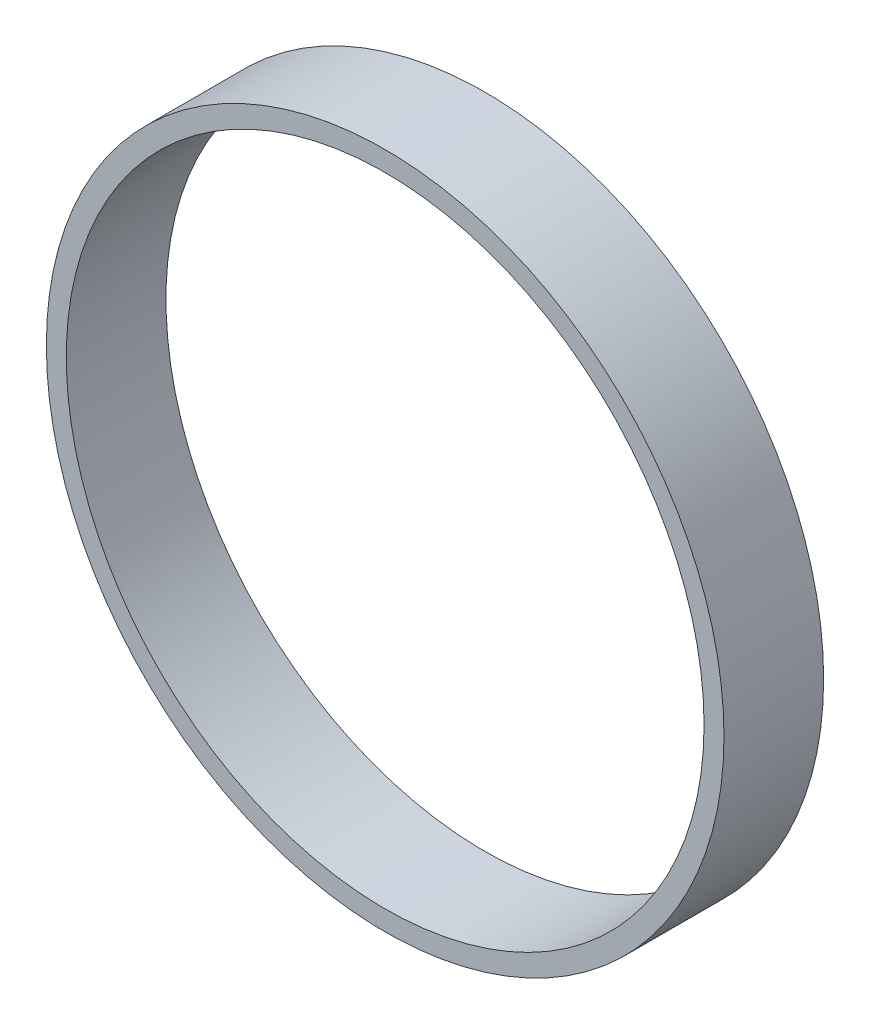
SolidWorks part; units mm, degrees
ref_plane "Front Plane" through (0, 0, 0) normal (0, 0, 1) x (1, 0, 0)
ref_plane "Top Plane" through (0, 0, 0) normal (0, 1, 0) x (1, 0, 0)
ref_plane "Right Plane" through (0, 0, 0) normal (1, 0, 0) x (0, 0, -1)
sketch "Sketch1" plane through (0, 0, 0) normal (0, 0, 1) x (1, 0, 0)
  circle A0 centre (0, 0) radius 32
  circle A1 centre (0, 0) radius 34
  dimension "D1" = 2
  dimension "D2" = 64
extrude "Boss-Extrude1" add sketch "Sketch1" along normal blind 10
